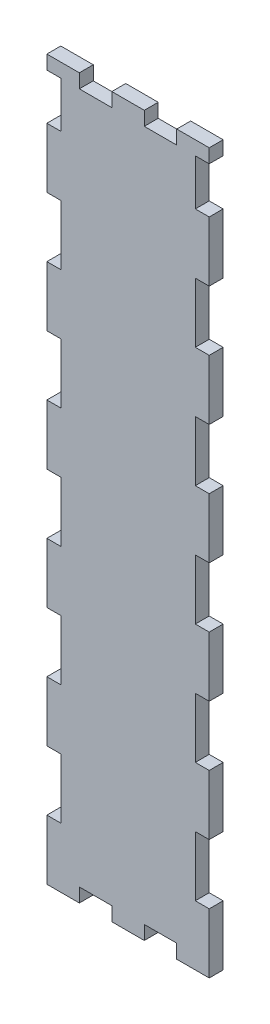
SolidWorks part; units mm, degrees
ref_plane "Front Plane" through (0, 0, 0) normal (0, 0, 1) x (1, 0, 0)
ref_plane "Top Plane" through (0, 0, 0) normal (0, 1, 0) x (1, 0, 0)
ref_plane "Right Plane" through (0, 0, 0) normal (1, 0, 0) x (0, 0, -1)
sketch "Sketch1" plane through (0, 0, 0) normal (0, 0, 1) x (1, 0, 0)
  line L0 (3.5, 74.5) -> (10.5, 74.5)
  line L1 (17.5, 77.5) -> (17.5, -77.5)
  line L2 (-17.5, 77.5) -> (-17.5, -77.5)
  line L3 (-10.5, -74.5) -> (-3.5, -74.5)
  line L4 (-3.5, -74.5) -> (-3.5, -77.5)
  line L5 (-17.5, 77.5) -> (17.5, -77.5) construction
  line L6 (-17.5, -77.5) -> (17.5, 77.5) construction
  line L9 (-17.5, 77.5) -> (-10.5, 77.5)
  line L10 (-10.5, 74.5) -> (-10.5, 77.5)
  line L11 (-3.5, 74.5) -> (-3.5, 77.5)
  line L12 (-3.5, 77.5) -> (3.5, 77.5)
  line L13 (3.5, 74.5) -> (3.5, 77.5)
  line L14 (10.5, 74.5) -> (10.5, 77.5)
  line L15 (10.5, 77.5) -> (17.5, 77.5)
  line L18 (-10.5, 74.5) -> (-3.5, 74.5)
  line L19 (-17.5, 0) -> (17.5, 0) construction
  line L21 (10.5, -77.5) -> (17.5, -77.5)
  line L22 (10.5, -74.5) -> (10.5, -77.5)
  line L23 (3.5, -74.5) -> (10.5, -74.5)
  line L24 (3.5, -74.5) -> (3.5, -77.5)
  line L25 (-3.5, -77.5) -> (3.5, -77.5)
  line L29 (-10.5, -74.5) -> (-10.5, -77.5)
  line L30 (-17.5, -77.5) -> (-10.5, -77.5)
  line L33 (17.5, 74.5) -> (17.5, 77.5)
  point P0 (0, 0)
  dimension "D1" = 155
  dimension "D2" = 35
  dimension "D3" = 7
  dimension "D4" = 3
extrude "Boss-Extrude1" add sketch "Sketch1" along normal blind 3
sketch "Sketch3" plane through (0, 0, 0) normal (0, 0, 1) x (1, 0, 0)
  line L1 (17.5, 77.5) -> (-17.5, 77.5) construction
  line L2 (-14.5, 74.5) -> (-14.5, 64.5833)
  line L3 (-14.5, 64.5833) -> (-17.5, 64.5833)
  line L4 (-17.5, 74.5) -> (-17.5, -77.5) construction
  line L5 (-17.5, 64.5833) -> (-17.5, 51.6667)
  line L6 (-17.5, 51.6667) -> (-14.5, 51.6667)
  line L7 (-14.5, 51.6667) -> (-14.5, 38.75)
  line L8 (-14.5, 38.75) -> (-17.5, 38.75)
  line L9 (-17.5, 38.75) -> (-17.5, 25.8333)
  line L10 (-17.5, 25.8333) -> (-14.5, 25.8333)
  line L11 (-14.5, 25.8333) -> (-14.5, 12.9167)
  line L12 (-14.5, 12.9167) -> (-17.5, 12.9167)
  line L13 (-17.5, 12.9167) -> (-17.5, 0)
  line L14 (-17.5, 0) -> (-14.5, 0)
  line L15 (-14.5, 0) -> (-14.5, -12.9167)
  line L16 (-14.5, -12.9167) -> (-17.5, -12.9167)
  line L17 (-17.5, -12.9167) -> (-17.5, -25.8333)
  line L18 (-17.5, -25.8333) -> (-14.5, -25.8333)
  line L19 (-14.5, -25.8333) -> (-14.5, -38.75)
  line L20 (-14.5, -38.75) -> (-17.5, -38.75)
  line L21 (-17.5, -38.75) -> (-17.5, -51.6667)
  line L22 (-17.5, -51.6667) -> (-14.5, -51.6667)
  line L23 (-14.5, -51.6667) -> (-14.5, -64.5833)
  line L24 (-14.5, -64.5833) -> (-17.5, -64.5833)
  line L25 (-17.5, -64.5833) -> (-17.5, -77.5)
  line L26 (-17.5, -77.5) -> (-14.5, -77.5)
  line L27 (0, 77.5) -> (0, -77.5) construction
  line L28 (-17.5, -77.5) -> (17.5, -77.5) construction
  line L29 (17.5, -77.5) -> (14.5, -77.5)
  line L30 (17.5, -64.5833) -> (17.5, -77.5)
  line L31 (14.5, -64.5833) -> (17.5, -64.5833)
  line L32 (14.5, -51.6667) -> (14.5, -64.5833)
  line L33 (17.5, -51.6667) -> (14.5, -51.6667)
  line L34 (17.5, -38.75) -> (17.5, -51.6667)
  line L35 (14.5, -38.75) -> (17.5, -38.75)
  line L36 (14.5, -25.8333) -> (14.5, -38.75)
  line L37 (17.5, -25.8333) -> (14.5, -25.8333)
  line L38 (17.5, -12.9167) -> (17.5, -25.8333)
  line L39 (14.5, -12.9167) -> (17.5, -12.9167)
  line L40 (14.5, 0) -> (14.5, -12.9167)
  line L41 (17.5, 0) -> (14.5, 0)
  line L42 (17.5, 12.9167) -> (17.5, 0)
  line L43 (14.5, 12.9167) -> (17.5, 12.9167)
  line L44 (14.5, 25.8333) -> (14.5, 12.9167)
  line L45 (17.5, 25.8333) -> (14.5, 25.8333)
  line L46 (17.5, 38.75) -> (17.5, 25.8333)
  line L47 (14.5, 38.75) -> (17.5, 38.75)
  line L48 (14.5, 51.6667) -> (14.5, 38.75)
  line L49 (17.5, 51.6667) -> (14.5, 51.6667)
  line L50 (17.5, 64.5833) -> (17.5, 51.6667)
  line L51 (14.5, 64.5833) -> (17.5, 64.5833)
  line L53 (14.5, 74.5) -> (14.5, 64.5833)
  line L54 (-17.5, 74.5) -> (-17.5, -64.5833)
  line L55 (17.5, -64.5833) -> (17.5, 74.5)
  line L56 (14.5, 74.5) -> (17.5, 74.5)
  line L57 (17.5, 74.5) -> (10.5, 74.5) construction
  line L58 (-17.5, 74.5) -> (-14.5, 74.5)
extrude "Cut-Extrude4" cut sketch "Sketch3" against normal blind 41 and the other way blind 18
equation "\"Thickness of material\"= 3mm"
equation "\"Length of box\"= 155mm"
equation "\"width of box\"= 55mm"
equation "\"D1@Boss-Extrude1\"=\"Thickness of material\""
equation "\"D8@Sketch3\"=\"Length of box\"/12"
equation "\"D2@Sketch3\"=\"Length of box\"/12"
equation "\"D9@Sketch3\"=\"Length of box\"/12"
equation "\"D3@Sketch3\"=\"Length of box\"/12"
equation "\"D10@Sketch3\"=\"Length of box\"/12"
equation "\"D4@Sketch3\"=\"Length of box\"/12"
equation "\"D11@Sketch3\"=\"Length of box\"/12"
equation "\"D5@Sketch3\"=\"Length of box\"/12"
equation "\"D12@Sketch3\"=\"Length of box\"/12"
equation "\"D6@Sketch3\"=\"Length of box\"/12"
equation "\"D13@Sketch3\"=\"Length of box\"/12"
equation "\"D7@Sketch3\"=\"Thickness of material\""
equation "\"D14@Sketch3\"=\"Thickness of material\""
equation "\"D15@Sketch3\"=\"Thickness of material\""
equation "\"D16@Sketch3\"=\"Thickness of material\""
equation "\"D17@Sketch3\"=\"Thickness of material\""
equation "\"D18@Sketch3\"=\"Thickness of material\""
equation "\"D19@Sketch3\"=\"Thickness of material\""
